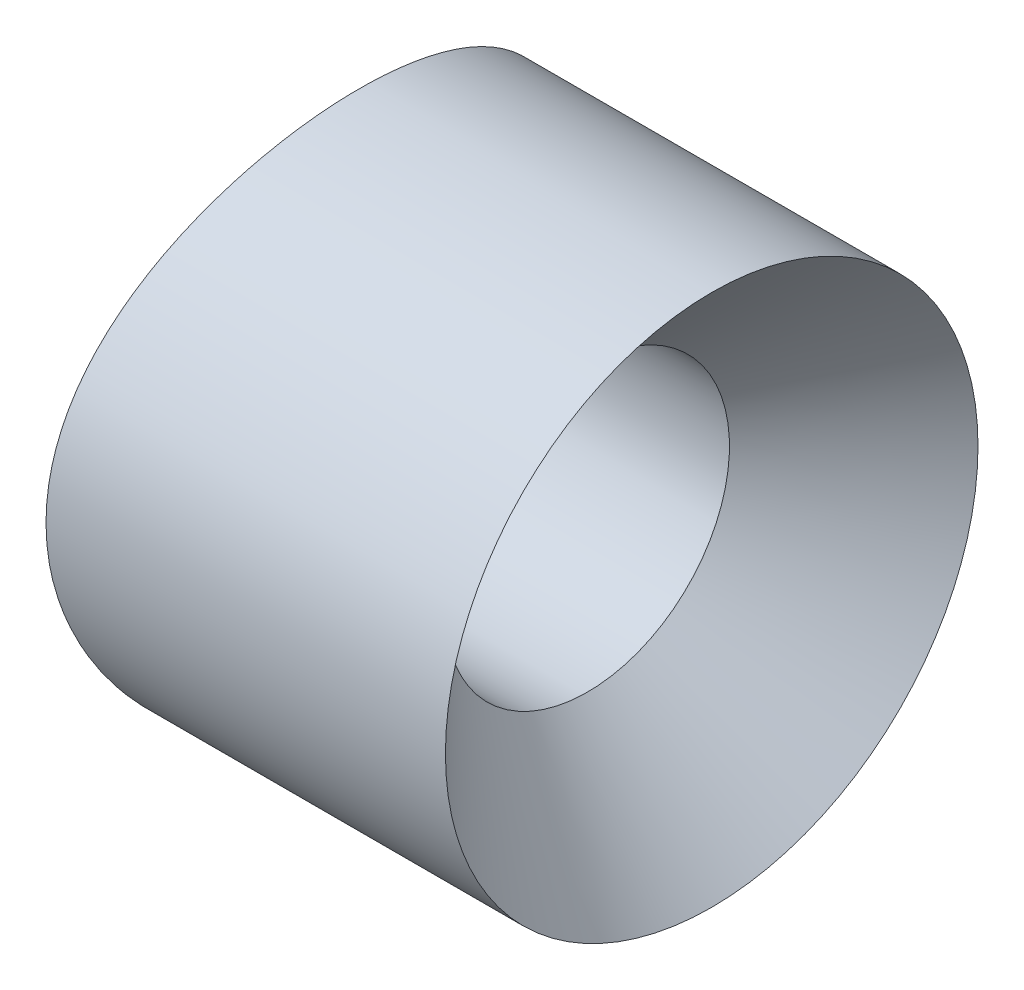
SolidWorks part; units mm, degrees
ref_plane "Vorne" through (0, 0, 0) normal (0, 0, 1) x (1, 0, 0)
ref_plane "Oben" through (0, 0, 0) normal (0, 1, 0) x (1, 0, 0)
ref_plane "Rechts" through (0, 0, 0) normal (1, 0, 0) x (0, 0, -1)
sketch "Skizze1" plane through (0, 0, 0) normal (0, 0, 1) x (1, 0, 0)
  line L0 (0, 0) -> (35.8128, 0) construction
  line L1 (0, 3) -> (4.5, 3)
  line L2 (4.5, 3) -> (3.1, 1.6)
  line L3 (3.1, 1.6) -> (0, 1.6)
  line L4 (0, 3) -> (0, 1.6)
  dimension "D2" = 4.5
  dimension "D3" = 1.4
  dimension "D4" = 45
  dimension "D5" = 6
revolve "Rotation1" add sketch "Skizze1" angle 360 about L0
sketch "Skizze2" plane through (0, 0, 0) normal (0, 1, 0) x (0, 0, -1)
  line L0 (3, 0) -> (-3, 0) construction
  line L1 (-3, 0) -> (3, 0)
  line L2 (3, -4.5) -> (3, 0) construction
  line L3 (-3, 0) -> (-3, -4.5) construction
  arc A0 (3, 0) -> (-3, 0) centre (0, 8.2728) cw
  dimension "D1" = 8.8
extrude "Linear austragen1" cut sketch "Skizze2" against normal mid plane 47
